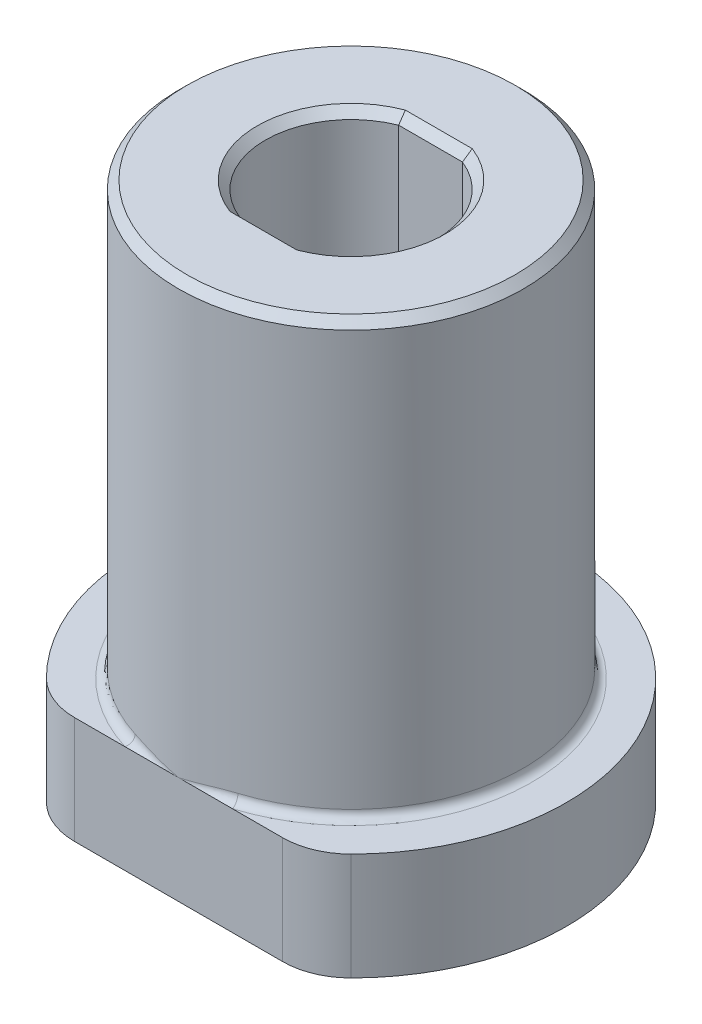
SolidWorks part; units mm, degrees
ref_plane "Front Plane" through (0, 0, 0) normal (0, 0, 1) x (1, 0, 0)
ref_plane "Top Plane" through (0, 0, 0) normal (0, 1, 0) x (1, 0, 0)
ref_plane "Right Plane" through (0, 0, 0) normal (1, 0, 0) x (0, 0, -1)
sketch "Sketch1" plane through (0, 0, 0) normal (0, 1, 0) x (1, 0, 0)
  circle A0 centre (0, 0) radius 7.9959
  point P0 (0, 0)
  dimension "D3" = 15.9918
extrude "Extrude1" add sketch "Sketch1" along normal blind 24.9936
sketch "Sketch5" plane through (0, 0, 0) normal (0, -1, 0) x (1, 0, 0)
  line L0 (-5.9969, 7.9959) -> (5.9969, 7.9959)
  arc A1 (-5.9969, 7.9959) -> (5.9969, 7.9959) centre (0, 0) ccw
  dimension "D1" = 19.9898
  dimension "D2" = 7.9959
extrude "Extrude3" add sketch "Sketch5" against normal blind 4.9784
fillet "Fillet1" radius 0.381 1 edges at (0, 4.9784, -7.9959)
fillet "Fillet2" radius 3.175 2 edges at (-5.9969, 2.4892, 7.9959) (5.9969, 2.4892, 7.9959)
sketch "Sketch4" plane through (0, 24.9936, 0) normal (0, 1, 0) x (1, 0, 0)
  line L0 (-1.4799, 3.6893) -> (1.4799, 3.6893)
  line L1 (-0.2714, 0) -> (-16.7902, 0) construction
  line L2 (-1.4799, -3.6893) -> (1.4799, -3.6893)
  arc A0 (1.4799, -3.6893) -> (1.4799, 3.6893) centre (0, 0) ccw
  arc A1 (-1.4799, 3.6893) -> (-1.4799, -3.6893) centre (0, 0) ccw
  dimension "D2" = 7.9502
  dimension "D1" = 7.3787
extrude "Extrude2" cut sketch "Sketch4" against normal through all
chamfer "Chamfer2" distance 0.381 angle 45 8 edges at (3.9751, 24.9936, 0) (0, 24.9936, 3.6893) (-3.9751, 24.9936, 0) (0, 24.9936, -3.6893) (0, 0, 3.6893) (3.9751, 0, 0) (-3.9751, 0, 0) (0, 0, -3.6893)
chamfer "Chamfer3" distance 0.381 angle 45 1 edges at (0, 24.9936, 7.9959)
